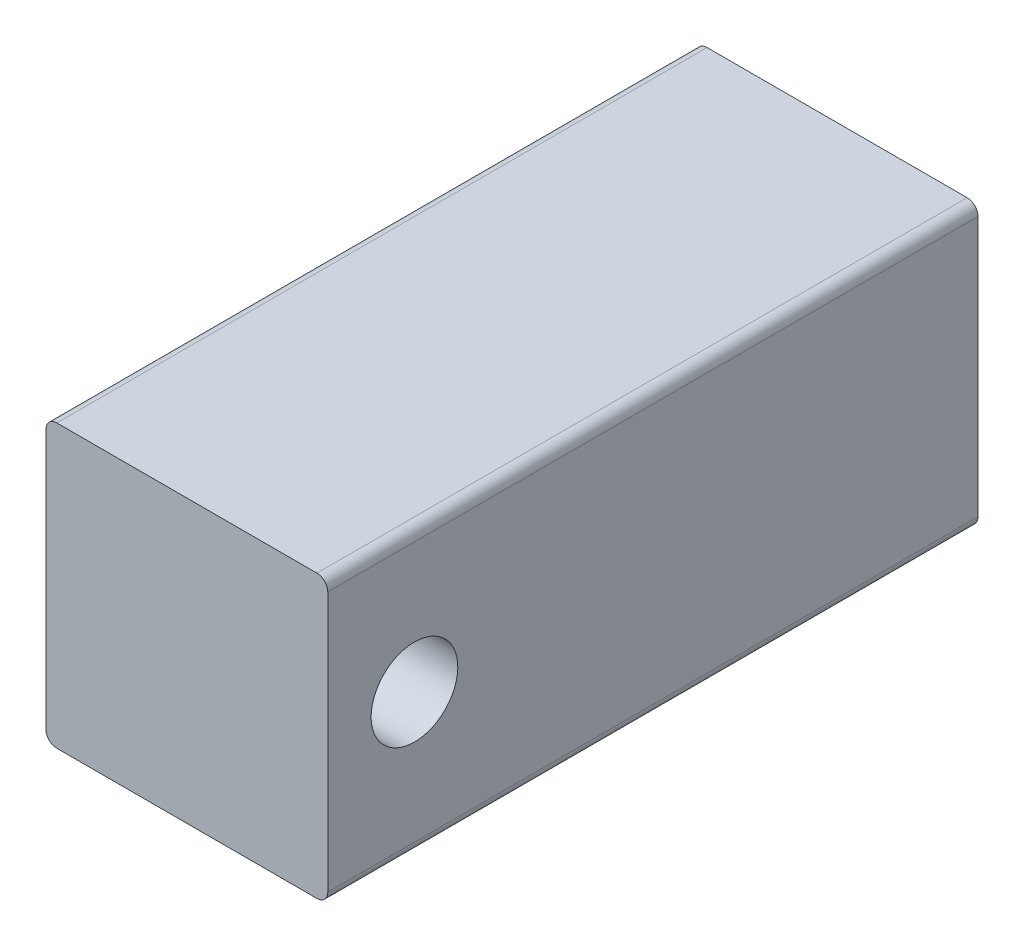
SolidWorks part; units mm, degrees
ref_plane "Plan de face" through (0, 0, 0) normal (0, 0, 1) x (1, 0, 0)
ref_plane "Plan de dessus" through (0, 0, 0) normal (0, 1, 0) x (1, 0, 0)
ref_plane "Plan de droite" through (0, 0, 0) normal (1, 0, 0) x (0, 0, -1)
sketch "Esquisse1" plane through (0, 0, 0) normal (0, 0, 1) x (1, 0, 0)
  line L1 (-6, 6.5) -> (6, 6.5)
  line L2 (-6.5, 6) -> (-6.5, -6)
  line L3 (-6, -6.5) -> (6, -6.5)
  line L4 (6.5, 6) -> (6.5, -6)
  arc A0 (6, -6.5) -> (6.5, -6) centre (6, -6) ccw
  arc A1 (-6.5, -6) -> (-6, -6.5) centre (-6, -6) ccw
  arc A2 (-6, 6.5) -> (-6.5, 6) centre (-6, 6) ccw
  arc A3 (6, 6.5) -> (6.5, 6) centre (6, 6) cw
  dimension "D4" = 0.5
  dimension "D1" = 13
  dimension "D2" = 6.5
  dimension "D3" = 6.5
extrude "Boss.-Extru.1" add sketch "Esquisse1" along normal blind 30
sketch "Esquisse2" plane through (6.5, 0, 0) normal (1, 0, 0) x (0, 0, -1)
  line L0 (-30, -6) -> (-30, 6) construction
  circle A0 centre (-26, 0) radius 2
  dimension "D1" = 4
  dimension "D2" = 4
extrude "Enlèv. mat.-Extru.1" cut sketch "Esquisse2" against normal through all
hole_wizard "Trou taraudé M41" positions "Esquisse4" profile "Esquisse3" tap size "M4" standard "ISO"
sketch "Esquisse4" plane through (0, 0, 0) normal (0, 0, -1) x (-1, 0, 0)
  point P0 (0, 0)
sketch "Esquisse3" plane through (0, 0, 0) normal (1, 0, 0) x (0, 1, 0)
  line L0 (0, 0) -> (0, 22.9914)
  line L1 (0, 22.9914) -> (1.65, 22)
  line L2 (1.65, 22) -> (1.65, 0)
  line L5 (1.65, 0) -> (0, 0)
  line L10 (0, 22.9914) -> (-1.65, 22) construction
  line L11 (0, -6.35) -> (0, 107.95) construction
  dimension "Diamètre du trou pour taraudage" = 3.3
  dimension "Profondeur du trou pour taraudage" = 22
  dimension "Angle de pointe" = 118
